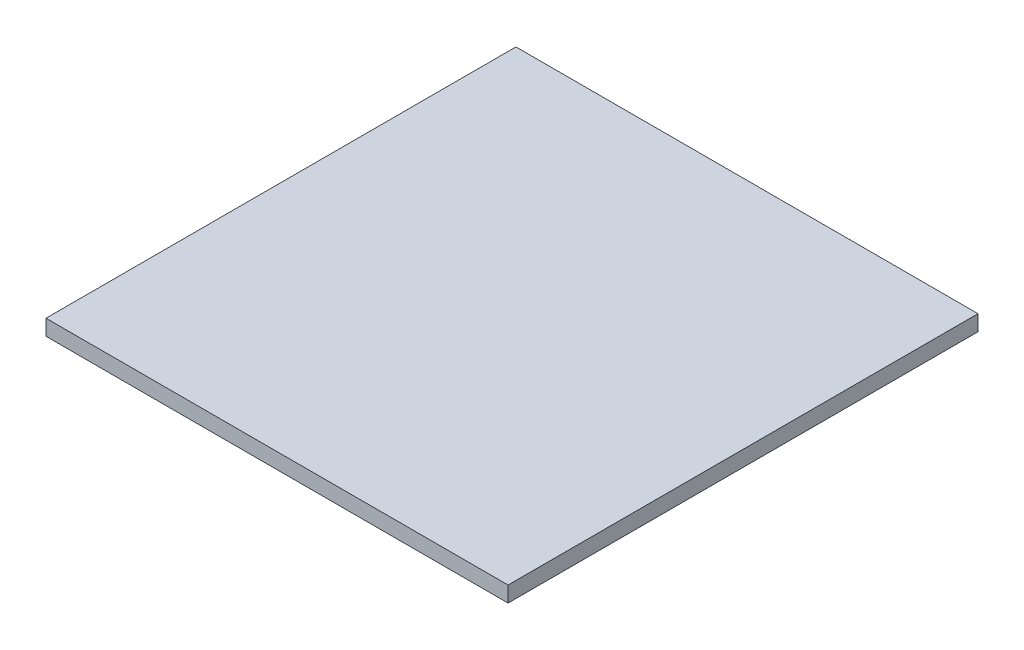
SolidWorks part; units mm, degrees
ref_plane "Front" through (0, 0, 0) normal (0, 0, 1) x (1, 0, 0)
ref_plane "Top" through (0, 0, 0) normal (0, 1, 0) x (1, 0, 0)
ref_plane "Right" through (0, 0, 0) normal (1, 0, 0) x (0, 0, -1)
sketch "Sketch1" plane through (0, 0, 0) normal (0, 1, 0) x (1, 0, 0)
  line L1 (-14.75, -15) -> (14.75, -15)
  line L2 (-14.75, -15) -> (-14.75, 15)
  line L3 (-14.75, 15) -> (14.75, 15)
  line L4 (14.75, -15) -> (14.75, 15)
  line L5 (-14.75, -15) -> (14.75, 15) construction
  line L6 (-14.75, 15) -> (14.75, -15) construction
  point P0 (0, 0)
  dimension "D1" = 29.5
  dimension "D2" = 30
extrude "Boss-Extrude1" add sketch "Sketch1" along normal mid plane 1
